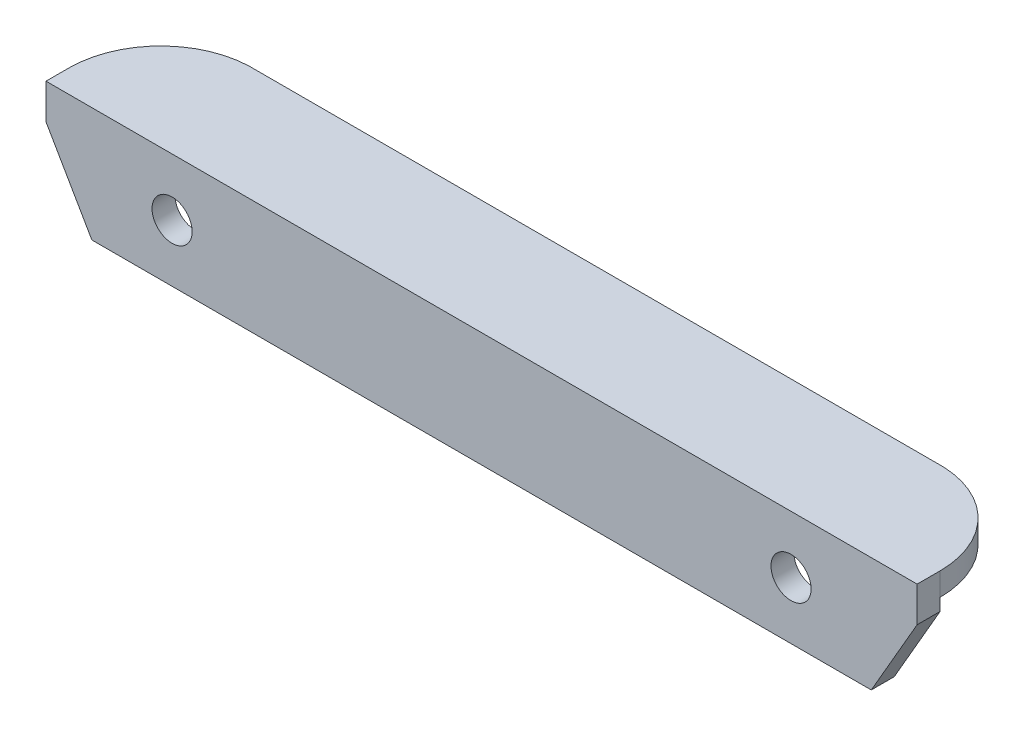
SolidWorks part; units mm, degrees
ref_plane "Front Plane" through (0, 0, 0) normal (0, 0, 1) x (1, 0, 0)
ref_plane "Top Plane" through (0, 0, 0) normal (0, 1, 0) x (1, 0, 0)
ref_plane "Right Plane" through (0, 0, 0) normal (1, 0, 0) x (0, 0, -1)
sketch "Sketch2" plane through (0, 0, 0) normal (1, 0, 0) x (0, 0, -1)
  line L0 (0, 0) -> (0, 10)
  line L1 (0, 10) -> (10, 10)
  line L2 (10, 10) -> (10, 8)
  line L3 (10, 8) -> (2, 8)
  line L4 (2, 8) -> (2, 0)
  line L5 (2, 0) -> (0, 0)
  dimension "D1" = 2
  dimension "D2" = 2
  dimension "D3" = 10
  dimension "D4" = 10
extrude "Extrude1" add sketch "Sketch2" along normal blind 76
sketch "Sketch3" plane through (0, 10, 0) normal (0, 1, 0) x (1, 0, 0)
  line L0 (0, 10) -> (0, 0) construction
  line L1 (76, 10) -> (76, 0) construction
  line L2 (68, 10.0062) -> (76, 10)
  line L3 (76, 10) -> (76, 2.0062)
  line L4 (8, 10.0062) -> (0, 10)
  line L5 (0, 10) -> (0, 2.0062)
  arc A0 (76, 2.0062) -> (68.0062, 10.0062) centre (68, 2.0062) ccw
  arc A1 (7.9938, 10.0062) -> (0, 2.0062) centre (8, 2.0062) ccw
  dimension "D1" = 16
  dimension "D2" = 16
extrude "Extrude2" cut sketch "Sketch3" against normal blind 76 contours A0 M3 M4 | A1 M4 M1
sketch "Sketch4" plane through (0, 0, -2) normal (0, 0, -1) x (-1, 0, 0)
  line L0 (-72.4813, 5) -> (-5.1246, 5) construction
  line L1 (0, 6.9282) -> (-4, 0)
  line L2 (-76, 0) -> (0, 0) construction
  line L5 (0, 0) -> (0, 8) construction
  line L6 (-4, 0) -> (0, 0)
  line L7 (0, 0) -> (0, 6.9282)
  line L8 (-76, 6.9282) -> (-72, 0)
  line L9 (-76, 0) -> (-76, 8) construction
  line L10 (-72, 0) -> (-76, 0)
  line L11 (-76, 0) -> (-76, 6.9282)
  circle A0 centre (-11, 5) radius 1.75
  circle A1 centre (-65, 5) radius 1.75
  dimension "D4" = 3.5
  dimension "D6" = 3.5
  dimension "D7" = 60
  dimension "D1" = 11
  dimension "D2" = 11
  dimension "D3" = 60
  dimension "D5" = 5
  dimension "D8" = 7
  dimension "D9" = 7
extrude "Extrude3" cut sketch "Sketch4" against normal blind 76
